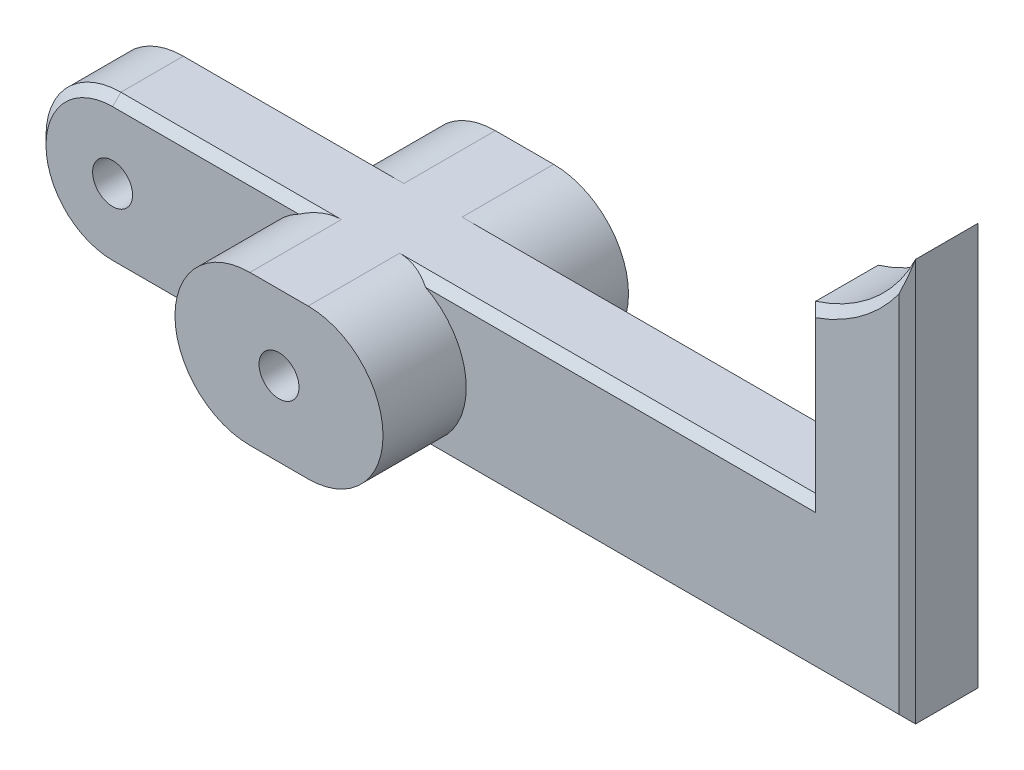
SolidWorks part; units mm, degrees
ref_plane "Front Plane" through (0, 0, 0) normal (0, 0, 1) x (1, 0, 0)
ref_plane "Top Plane" through (0, 0, 0) normal (0, 1, 0) x (1, 0, 0)
ref_plane "Right Plane" through (0, 0, 0) normal (1, 0, 0) x (0, 0, -1)
sketch "Sketch1" plane through (0, 0, 0) normal (0, 0, 1) x (1, 0, 0)
  line L13 (102.5, 48) -> (102.5, 28)
  line L14 (10, 28) -> (102.5, 28)
  line L15 (10, 28) -> (10, 10)
  line L16 (10, 10) -> (114.5, 10)
  line L18 (114.5, 58.361) -> (114.5, 10)
  circle A1 centre (19, 19) radius 2.4
  arc A2 (102.5, 48) -> (114.5, 58.361) centre (96.5, 67.0788) ccw
  circle A3 centre (49, 19) radius 2.4
  point P8 (10, 19)
  dimension "D1" = 4.8
  dimension "D3" = 20
  dimension "D8" = 4.8
  dimension "D2" = 9
  dimension "D4" = 18
  dimension "D5" = 12
  dimension "D6" = 104.5
  dimension "D7" = 6
  dimension "D9" = 30
  dimension "D10" = 10
  dimension "D11" = 10
  dimension "D12" = 20
extrude "Boss-Extrude1" add sketch "Sketch1" along normal mid plane 9.5
fillet "Fillet1" radius 9 2 edges at (10, 10, 0) (10, 28, 0)
chamfer "Chamfer1" distance 1 angle 45 14 edges at (66.75, 10, -4.75) (12.636, 12.636, -4.75) (12.636, 25.364, -4.75) (114.5, 34.1805, -4.75) (109.5705, 51.9407, -4.75) (102.5, 38, -4.75) (60.75, 28, -4.75) (66.75, 10, 4.75) (12.636, 12.636, 4.75) (12.636, 25.364, 4.75) (114.5, 34.1805, 4.75) (109.5705, 51.9407, 4.75) (102.5, 38, 4.75) (60.75, 28, 4.75)
sketch "Sketch2" plane through (0, 0, 0) normal (0, 0, 1) x (1, 0, 0)
  line L0 (45.5, 19) -> (52.5, 19) construction
  line L1 (45.5, 28) -> (52.5, 28)
  line L2 (45.5, 10) -> (52.5, 10)
  arc A0 (45.5, 28) -> (45.5, 10) centre (45.5, 19) ccw
  arc A1 (52.5, 10) -> (52.5, 28) centre (52.5, 19) ccw
  circle A2 centre (49, 19) radius 2.4
  point P3 (49, 19)
  dimension "D3" = 4.8
  dimension "D1" = 18
  dimension "D2" = 7
extrude "Boss-Extrude2" add sketch "Sketch2" along normal mid plane 29.5
